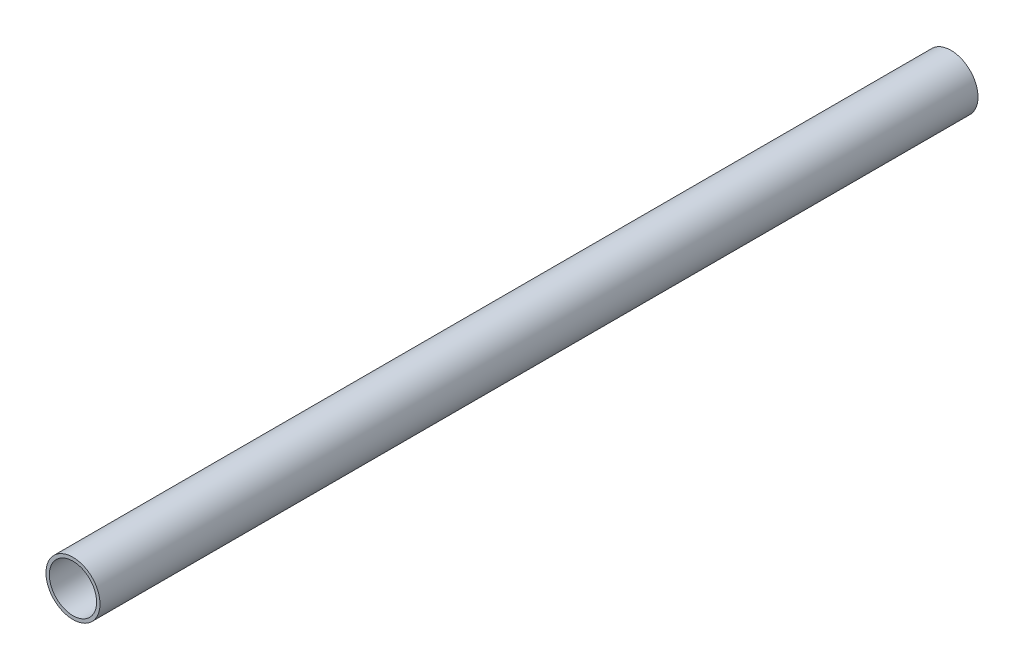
SolidWorks part; units mm, degrees
ref_plane "Face" through (0, 0, 0) normal (0, 0, 1) x (1, 0, 0)
ref_plane "Dessus" through (0, 0, 0) normal (0, 1, 0) x (1, 0, 0)
ref_plane "Droite" through (0, 0, 0) normal (1, 0, 0) x (0, 0, -1)
sketch "Esquisse1" plane through (0, 0, 0) normal (0, 0, 1) x (1, 0, 0)
  circle A0 centre (0, 0) radius 1.05
  circle A1 centre (0, 0) radius 1.2
  dimension "D1" = 2.1
  dimension "D2" = 2.4
extrude "Extrusion1" add sketch "Esquisse1" along normal blind 39
